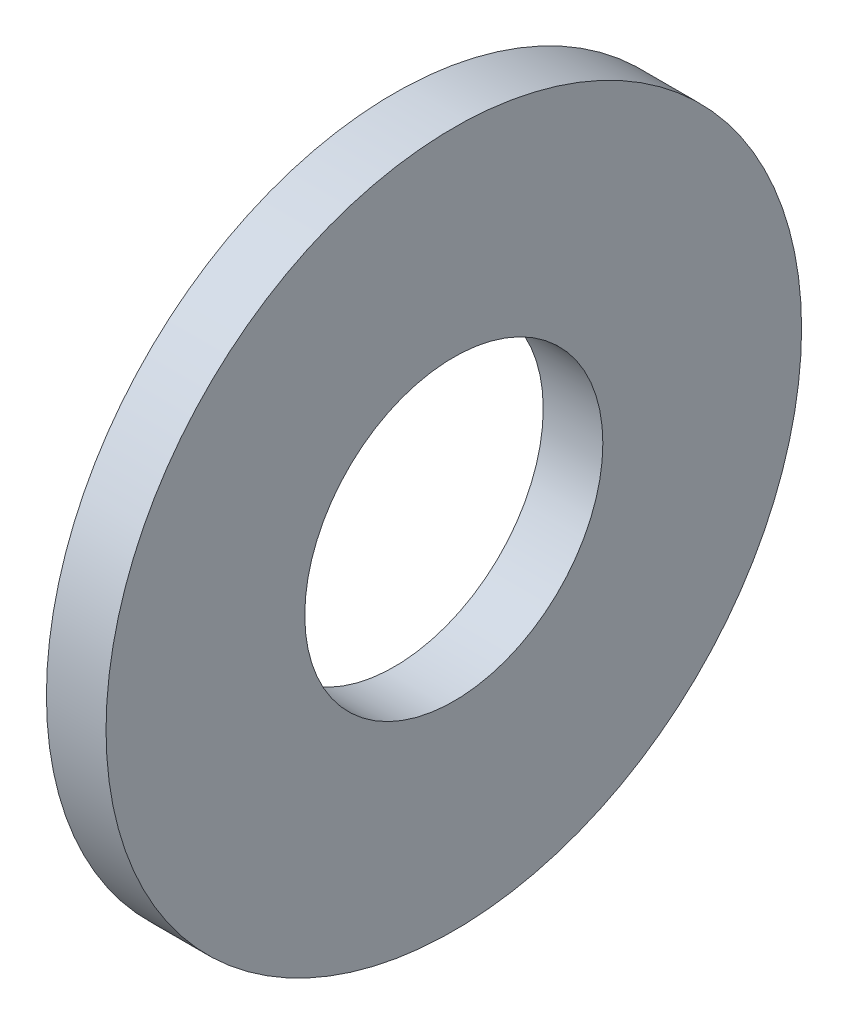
SolidWorks part; units mm, degrees
ref_plane "Front Plane" through (0, 0, 0) normal (1, 0, 0) x (0, 1, 0)
ref_plane "Top Plane" through (0, 0, 0) normal (0, 0, 1) x (0, 1, 0)
ref_plane "Right Plane" through (0, 0, 0) normal (0, 1, 0) x (-1, 0, 0)
sketch "Sketch1" plane through (0, 0, 0) normal (1, 0, 0) x (0, 1, 0)
  circle A0 centre (0, 0) radius 3.5
  circle A1 centre (0, 0) radius 1.5
  dimension "D1" = 3
  dimension "D2" = 7
extrude "Boss-Extrude1" add sketch "Sketch1" along normal blind 0.6
